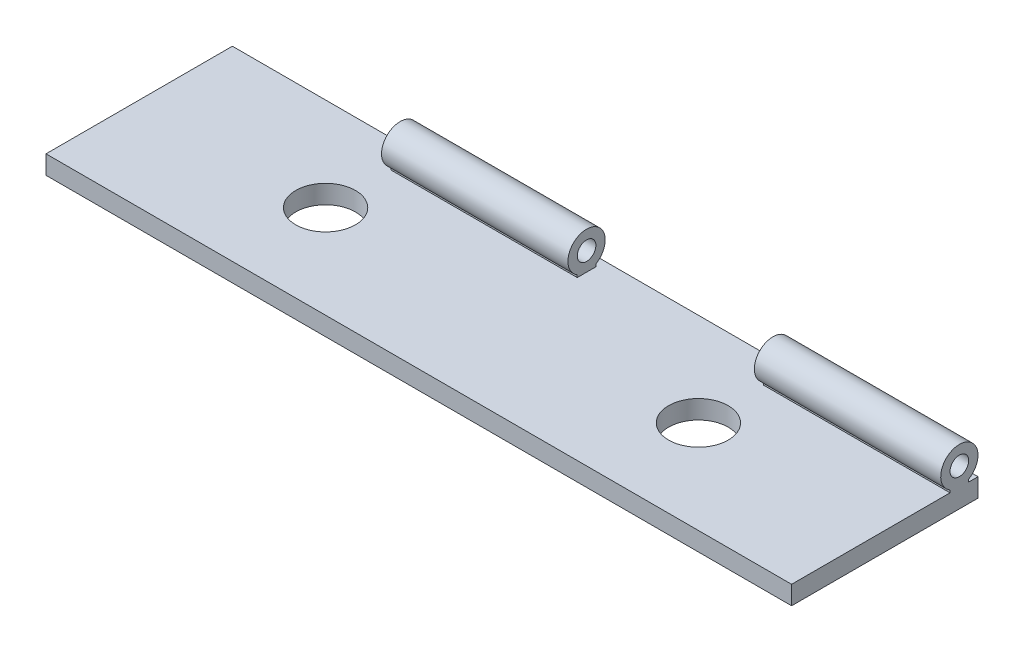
SolidWorks part; units mm, degrees
ref_plane "Front" through (0, 0, 0) normal (0, 0, 1) x (1, 0, 0)
ref_plane "Top" through (0, 0, 0) normal (0, 1, 0) x (1, 0, 0)
ref_plane "Right" through (0, 0, 0) normal (1, 0, 0) x (0, 0, -1)
sketch "Sketch1" plane through (0, 0, 0) normal (0, 1, 0) x (1, 0, 0)
  line L0 (0, 5) -> (40, 5) construction
  line L1 (0, 0) -> (40, 0)
  line L2 (0, 0) -> (0, 10)
  line L3 (0, 10) -> (40, 10)
  line L4 (40, 0) -> (40, 10)
  line L5 (20, 10) -> (20, 0) construction
  circle A0 centre (30, 5) radius 1.6
  circle A1 centre (10, 5) radius 1.6
  dimension "D2" = 40
  dimension "D3" = 20
  dimension "D1" = 10
  dimension "D4" = 10
extrude "Extrude1" add sketch "Sketch1" along normal blind 1
sketch "Sketch2" plane through (40, 0, 0) normal (1, 0, 0) x (0, 0, -1)
  line L3 (8.5, 1) -> (9.5, 1)
  line L4 (9.5, 1) -> (9.5, 1.134)
  line L5 (8.5, 1) -> (8.5, 1.134)
  arc A0 (9.5, 1.134) -> (8.5, 1.134) centre (9, 2) ccw
  circle A1 centre (9, 2) radius 0.5
extrude "Extrude2" add sketch "Sketch2" against normal blind 40
sketch "Sketch4" plane through (0, 1, 0) normal (0, 1, 0) x (-1, 0, 0)
  line L0 (0, 0) -> (-40, 0) construction
  line L1 (0, 0) -> (-10, 0)
  line L2 (0, 0) -> (0, -15.8478)
  line L3 (0, -15.8478) -> (-10, -15.8478)
  line L4 (-10, 0) -> (-10, -15.8478)
  line L5 (-20, 0) -> (-30, 0)
  line L6 (-20, 0) -> (-20, -14.2154)
  line L7 (-20, -14.2154) -> (-30, -14.2154)
  line L8 (-30, 0) -> (-30, -14.2154)
  dimension "D1" = 10
  dimension "D2" = 10
extrude "Cut-Extrude2" cut sketch "Sketch4" along normal blind 10
